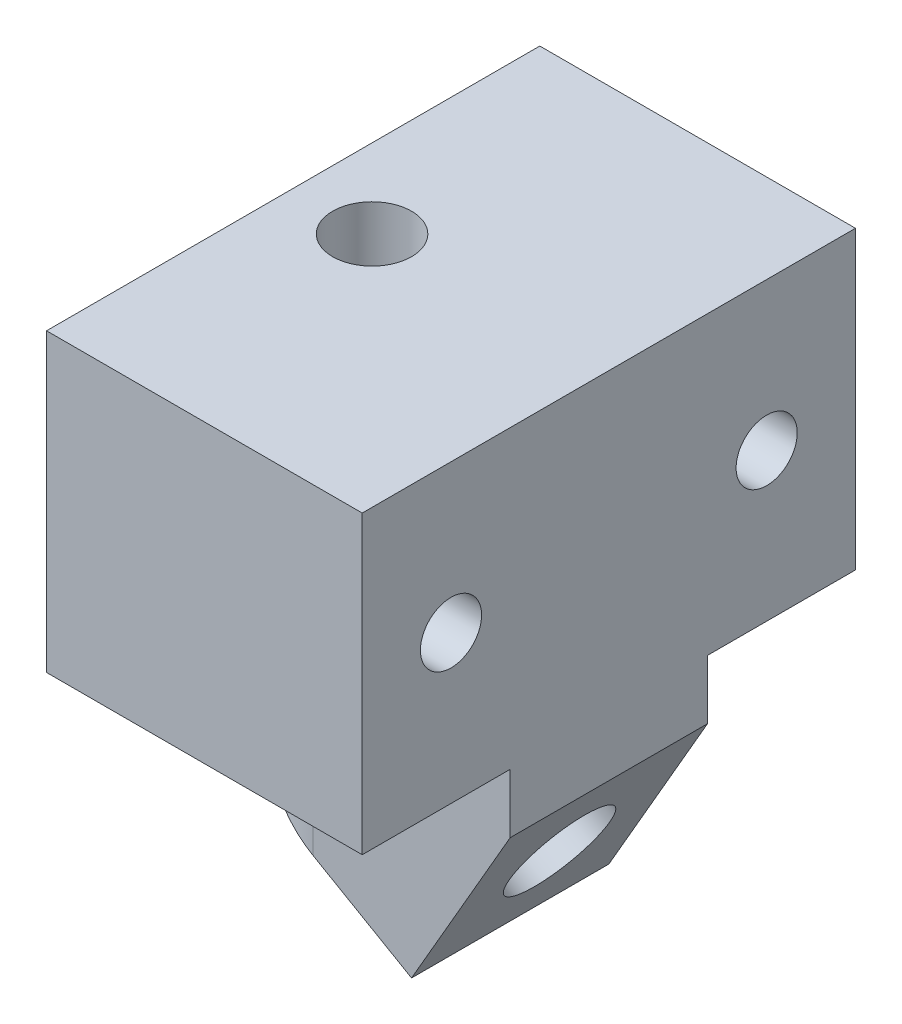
SolidWorks part; units mm, degrees
ref_plane "Front Plane" through (0, 0, 0) normal (0, 0, 1) x (1, 0, 0)
ref_plane "Top Plane" through (0, 0, 0) normal (0, 1, 0) x (1, 0, 0)
ref_plane "Right Plane" through (0, 0, 0) normal (1, 0, 0) x (0, 0, -1)
sketch "Sketch3" plane through (0, 0, 0) normal (1, 0, 0) x (0, 0, -1)
  line L0 (0, 0) -> (12.5, 0)
  line L1 (12.5, 0) -> (12.5, 15)
  line L2 (12.5, 15) -> (-12.5, 15)
  line L3 (-12.5, 15) -> (-12.5, 0)
  line L4 (-12.5, 0) -> (0, 0)
  dimension "D1" = 15
  dimension "D2" = 12.5
  dimension "D3" = 25
extrude "Boss-Extrude3" add sketch "Sketch3" along normal blind 16
sketch "Sketch4" plane through (0, 0, 0) normal (0, 0, 1) x (1, 0, 0)
  line L0 (16, 0) -> (16, -3)
  line L1 (16, -3) -> (11, -11.6603)
  line L2 (11, -11.6603) -> (1, -5.8868)
  line L3 (1, -5.8868) -> (1, 0)
  line L4 (16, 0) -> (0, 0) construction
  line L5 (1, 0) -> (16, 0)
  dimension "D1" = 3
  dimension "D2" = 150
  dimension "D3" = 15
  dimension "D4" = 10
extrude "Boss-Extrude4" add sketch "Sketch4" along normal mid plane 10
fillet "Fillet1" radius 5 2 edges at (1, -2.9434, -5) (1, -2.9434, 5)
hole_wizard "1/4-20 Tapped Hole1" positions "Sketch6" profile "Sketch5" tap size "1/4-20" standard "ANSI Inch"
sketch "Sketch6" plane through (13.299, -7.6782, 0) normal (0.866, -0.5, 0) x (0, 0, -1)
  line L0 (-5, -4.5981) -> (5, -4.5981) construction
  line L1 (-5, -4.5981) -> (-5, 5.4019) construction
  point P0 (0, 0.4019)
  dimension "D1" = 5
  dimension "D2" = 5
sketch "Sketch5" plane through (13.5, -7.3301, 0) normal (0, 0, 1) x (0.5, 0.866, 0)
  line L0 (0, 0) -> (0, 13.5338)
  line L1 (0, 13.5338) -> (2.5527, 12)
  line L2 (2.5527, 12) -> (2.5527, 0)
  line L5 (2.5527, 0) -> (0, 0)
  line L10 (0, 13.5338) -> (-2.5527, 12) construction
  line L11 (0, -6.35) -> (0, 107.95) construction
  dimension "Tap Drill Dia." = 5.1054
  dimension "Tap Drill Depth" = 12
  dimension "Drill Angle" = 118
hole_wizard "Ø4.0 (4) Diameter Hole1" positions "Sketch8" profile "Sketch7" hole size "Ø4.0" standard "ANSI Metric"
sketch "Sketch8" plane through (0, 15, 0) normal (0, 1, 0) x (1, 0, 0)
  line L0 (16, -12.5) -> (0, -12.5) construction
  line L1 (16, 12.5) -> (16, -12.5) construction
  point P0 (4, 0)
  dimension "D1" = 12.5
  dimension "D2" = 12
sketch "Sketch7" plane through (4, 15, 0) normal (1, 0, 0) x (0, 0, 1)
  line L0 (0, 0) -> (0, 17.2017)
  line L1 (0, 17.2017) -> (2, 16)
  line L2 (2, 16) -> (2, 0)
  line L5 (2, 0) -> (0, 0)
  line L10 (0, 17.2017) -> (-2, 16) construction
  line L11 (0, -6.35) -> (0, 107.95) construction
  dimension "Hole Dia." = 4
  dimension "Hole Depth" = 16
  dimension "Drill Angle" = 118
hole_wizard "Ø3.1 (3.1) Diameter Hole1" positions "Sketch10" profile "Sketch9" hole size "Ø3.1" standard "ANSI Metric"
sketch "Sketch10" plane through (0, 0, 0) normal (-1, 0, 0) x (0, 0, 1)
  line L0 (-8, 7.5) -> (8, 7.5) construction
  line L1 (8, 7.5) -> (12.5, 7.5) construction
  line L2 (12.5, 15) -> (12.5, 0) construction
  line L4 (-8, 7.5) -> (-12.5, 7.5) construction
  line L5 (-12.5, 0) -> (-12.5, 15) construction
  line L7 (-8, 15) -> (-8, 7.5) construction
  line L8 (-12.5, 15) -> (12.5, 15) construction
  line L9 (-8, 7.5) -> (-8, 0) construction
  line L10 (12.5, 0) -> (-12.5, 0) construction
  point P0 (-8, 7.5)
  point P2 (8, 7.5)
  dimension "D1" = 16
sketch "Sketch9" plane through (0, 7.5, -8) normal (0, 1, 0) x (0, 0, 1)
  line L0 (0, 0) -> (0, 16.0001)
  line L1 (0, 16.0001) -> (1.55, 16.0001)
  line L2 (1.55, 16.0001) -> (1.55, 0)
  line L5 (1.55, 0) -> (0, 0)
  line L11 (0, -6.35) -> (0, 107.95) construction
  dimension "Thru Hole Dia." = 3.1
  dimension "Thru Hole Depth" = 16.0001
hole_wizard "M3x0.5 Tapped Hole1" positions "Sketch15" profile "Sketch14" tap size "M3x0.5" standard "ANSI Metric"
sketch "Sketch15" plane through (0, 0, 5) normal (0, 0, 1) x (1, 0, 0)
  line L0 (3.1077, -1.3301) -> (13.5, -7.3301) construction
  line L1 (11, -11.6603) -> (16, -3) construction
  point P0 (9.1699, -4.8301)
  dimension "D1" = 5
sketch "Sketch14" plane through (9.1699, -4.8301, 5) normal (1, 0, 0) x (0, -1, 0)
  line L0 (0, 0) -> (0, 17.5)
  line L1 (0, 17.5) -> (1.25, 17.5)
  line L2 (1.25, 17.5) -> (1.25, 0)
  line L5 (1.25, 0) -> (0, 0)
  line L11 (0, -6.35) -> (0, 107.95) construction
  dimension "Thru Tap Drill Dia." = 2.5
  dimension "Thru Tap Drill Depth" = 17.5
